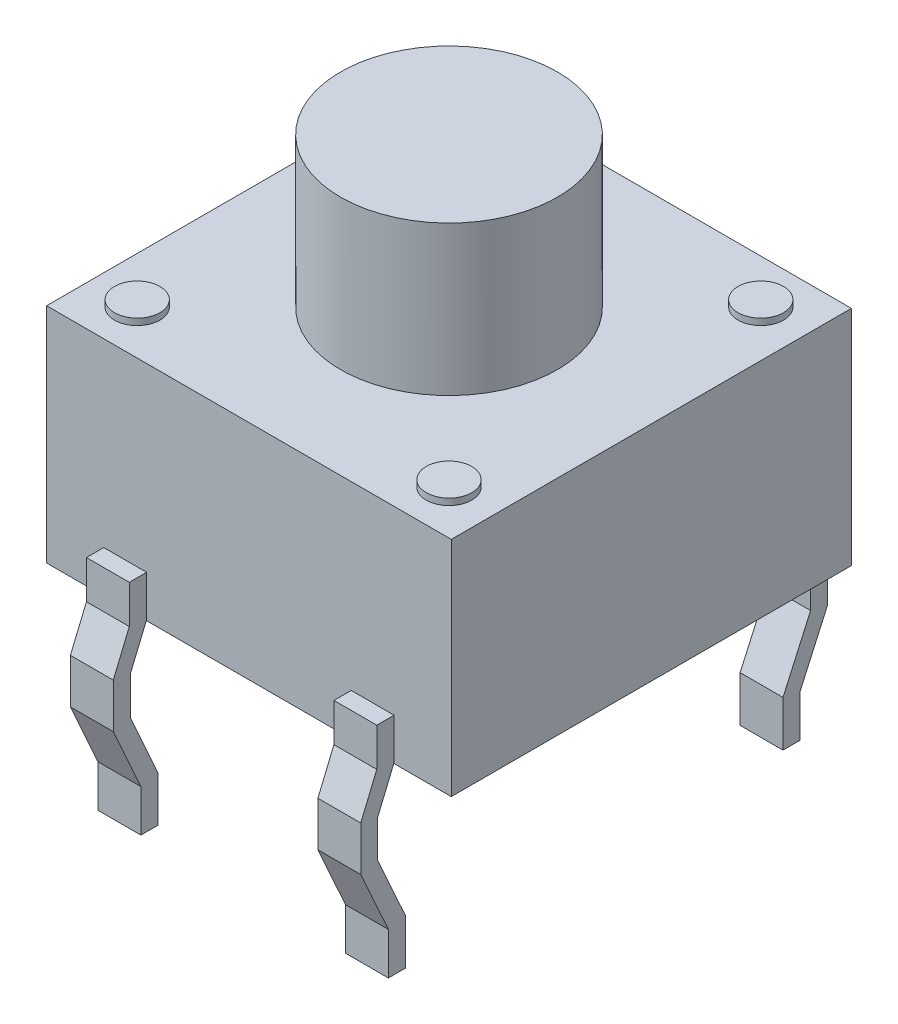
SolidWorks part; units mm, degrees
ref_plane "Plan de face" through (0, 0, 0) normal (0, 0, 1) x (1, 0, 0)
ref_plane "Plan de dessus" through (0, 0, 0) normal (0, 1, 0) x (1, 0, 0)
ref_plane "Plan de droite" through (0, 0, 0) normal (1, 0, 0) x (0, 0, -1)
sketch "Esquisse1" plane through (0, 0, 0) normal (0, 1, 0) x (1, 0, 0)
  line L0 (0, 0) -> (0, 3.08) construction
  line L1 (-3.115, -3.08) -> (3.115, -3.08)
  line L2 (-3.115, -3.08) -> (-3.115, 3.08)
  line L3 (-3.115, 3.08) -> (3.115, 3.08)
  line L4 (3.115, -3.08) -> (3.115, 3.08)
  line L5 (0, 3.08) -> (3.115, 0) construction
  line L6 (3.115, 0) -> (0, 0) construction
  dimension "D1" = 6.23
  dimension "D2" = 6.16
extrude "Extrusion1" add sketch "Esquisse1" along normal blind 3.43
sketch "Esquisse2" plane through (0, 3.43, 0) normal (0, 1, 0) x (-1, 0, 0)
  circle A0 centre (0, 0) radius 1.67
  dimension "D1" = 3.34
extrude "Extrusion2" add sketch "Esquisse2" along normal blind 2.3
sketch "Esquisse3" plane through (0, 0, 3.08) normal (0, 0, 1) x (1, 0, 0)
  line L0 (0, -1.7296) -> (0, 2.2567) construction
  line L1 (1.575, 0.6459) -> (2.235, 0.6459)
  line L2 (1.575, 0.6459) -> (1.575, 0.3844)
  line L3 (1.575, 0.3844) -> (2.235, 0.3844)
  line L4 (2.235, 0.6459) -> (2.235, 0.3844)
  line L5 (1.905, 2.2567) -> (1.905, -1.7296) construction
  line L6 (1.575, -0.6236) -> (1.575, 1.1812) construction
  line L7 (2.235, -0.9882) -> (2.235, 1.5214) construction
  line L8 (3.2331, 0.3844) -> (1.2877, 0.3844) construction
  line L9 (3.2331, 0.6459) -> (1.2877, 0.6459) construction
  line L10 (3.1577, 0.5144) -> (1.3675, 0.5144) construction
  dimension "D1" = 1.905
  dimension "D2" = 0.33
  dimension "D3" = 0.33
  dimension "D4" = 0.13
ref_plane "Plan1" through (1.575, 0, 0) normal (1, 0, 0) x (0, 0, -1)
sketch "Esquisse4" plane through (1.575, 0, 0) normal (1, 0, 0) x (0, 0, -1)
  line L0 (-2.8776, 0.5029) -> (-3.2037, 0.5029)
  line L2 (-3.2037, 0.5029) -> (-3.2037, 0.0279)
  line L3 (-3.2037, 0.0279) -> (-3.4504, -0.5632)
  line L4 (-3.4504, -0.5632) -> (-3.4504, -1.1911)
  line L5 (-3.4504, -1.1911) -> (-3.0253, -2.1355)
  line L6 (-3.0253, -2.1355) -> (-3.0253, -2.8138)
  line L7 (0, 0.0322) -> (0, -3.2332) construction
  line L8 (-3.125, -1.0945) -> (-3.125, -3.4532) construction
  line L9 (-5.6151, -2.8138) -> (2.1799, -2.8138) construction
  line L10 (-3.6368, 0.1862) -> (-5.7176, 0.1862) construction
  line L11 (-4.0388, -1.8138) -> (2.3927, -1.8138) construction
  dimension "D1" = 3.125
  dimension "D2" = 3
  dimension "D3" = 1
sweep "Balayage1" add profiles "Esquisse3" path "Esquisse4"
mirror "Symétrie1" about plane through (0, 0, 0) normal (1, 0, 0) of "Balayage1"
mirror "Symétrie2" about plane through (0, 0, 0) normal (0, 0, 1) of "Symétrie1", "Balayage1"
sketch "Esquisse5" plane through (0, 3.43, 0) normal (0, 1, 0) x (-1, 0, 0)
  line L0 (-2.4, 2.4) -> (2.4, 2.4) construction
  line L1 (2.4, 2.4) -> (2.4, -2.4) construction
  line L2 (2.4, -2.4) -> (-2.4, -2.4) construction
  line L3 (-2.4, -2.4) -> (-2.4, 2.4) construction
  line L4 (0, 0) -> (-2.4, 0) construction
  line L5 (-2.4, 0) -> (0, 2.4) construction
  line L6 (0, 2.4) -> (0, 0) construction
  circle A0 centre (-2.4, 2.4) radius 0.35
  circle A1 centre (-2.4, -2.4) radius 0.35
  circle A2 centre (2.4, -2.4) radius 0.35
  circle A3 centre (2.4, 2.4) radius 0.35
  dimension "D1" = 0.7
extrude "Extrusion3" add sketch "Esquisse5" along normal blind 0.1
